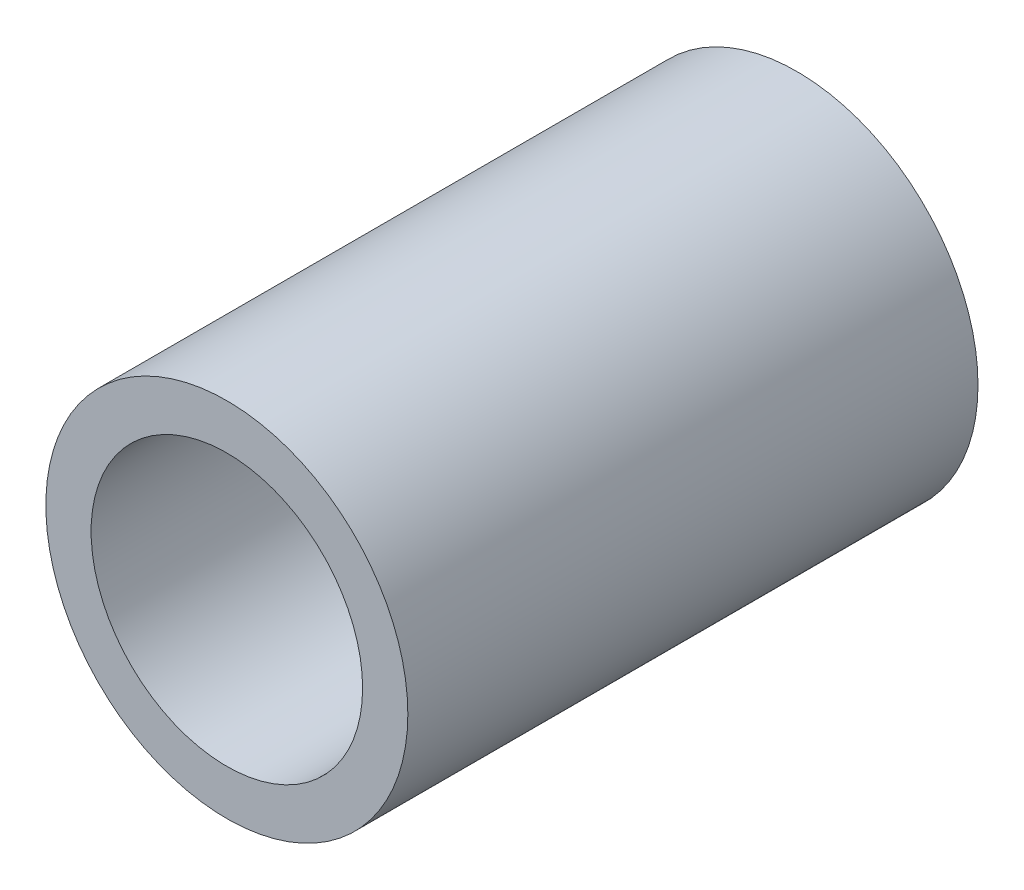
SolidWorks part; units mm, degrees
ref_plane "Front" through (0, 0, 0) normal (0, 0, 1) x (1, 0, 0)
ref_plane "Top" through (0, 0, 0) normal (0, 1, 0) x (1, 0, 0)
ref_plane "Right" through (0, 0, 0) normal (1, 0, 0) x (0, 0, -1)
sketch "Esquisse1" plane through (0, 0, 0) normal (0, 0, 1) x (1, 0, 0)
  circle A0 centre (0, 0) radius 10
  circle A1 centre (0, 0) radius 7.5
  dimension "D1" = 20
  dimension "D2" = 2.5
extrude "Boss.-Extru.1" add sketch "Esquisse1" along normal blind 31.5
